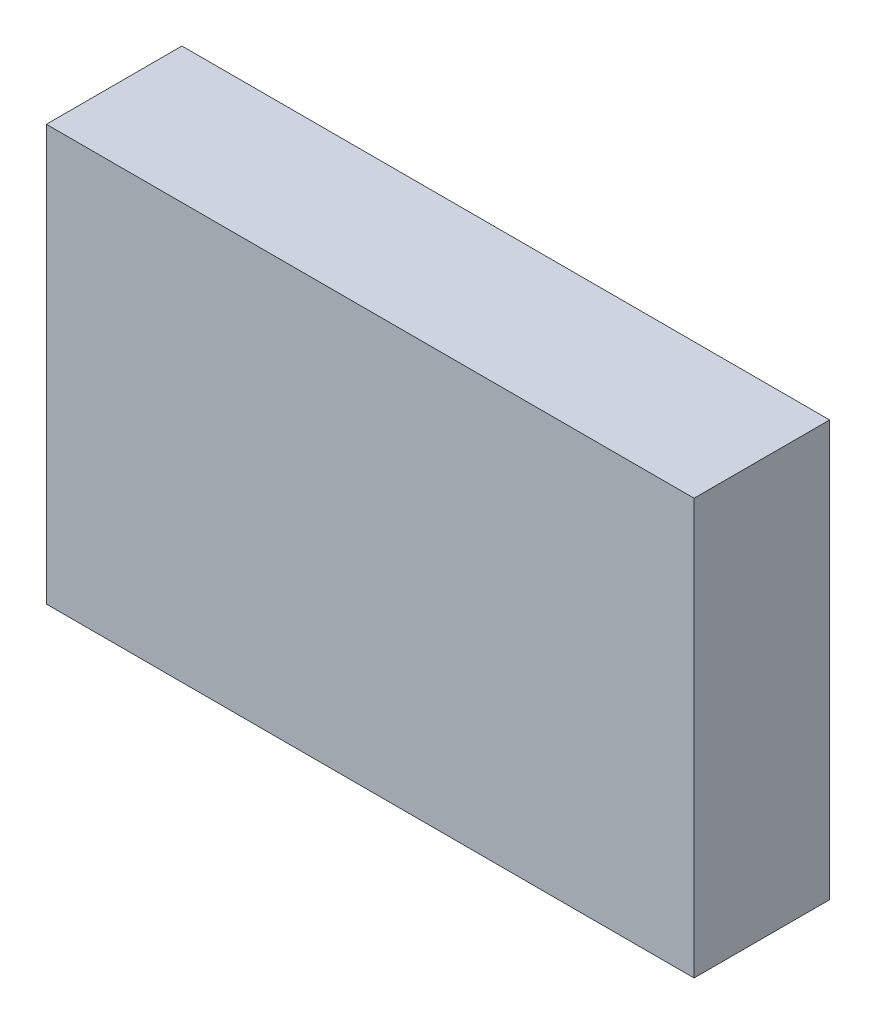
SolidWorks part; units mm, degrees
ref_plane "Front Plane" through (0, 0, 0) normal (1, 0, 0) x (0, 1, 0)
ref_plane "Top Plane" through (0, 0, 0) normal (0, 0, 1) x (0, 1, 0)
ref_plane "Right Plane" through (0, 0, 0) normal (0, 1, 0) x (-1, 0, 0)
sketch "Sketch1" plane through (0, 0, 0) normal (0, 0, 1) x (0, 1, 0)
  line L1 (-311.3905, 485.394) -> (311.3905, 485.394)
  line L2 (-311.3905, 485.394) -> (-311.3905, -485.394)
  line L3 (-311.3905, -485.394) -> (311.3905, -485.394)
  line L4 (311.3905, 485.394) -> (311.3905, -485.394)
  line L5 (-311.3905, 485.394) -> (311.3905, -485.394) construction
  line L6 (-311.3905, -485.394) -> (311.3905, 485.394) construction
  point P0 (0, 0)
  dimension "D1" = 970.788
  dimension "D2" = 622.781
extrude "Boss-Extrude1" add sketch "Sketch1" along normal mid plane 203.2
